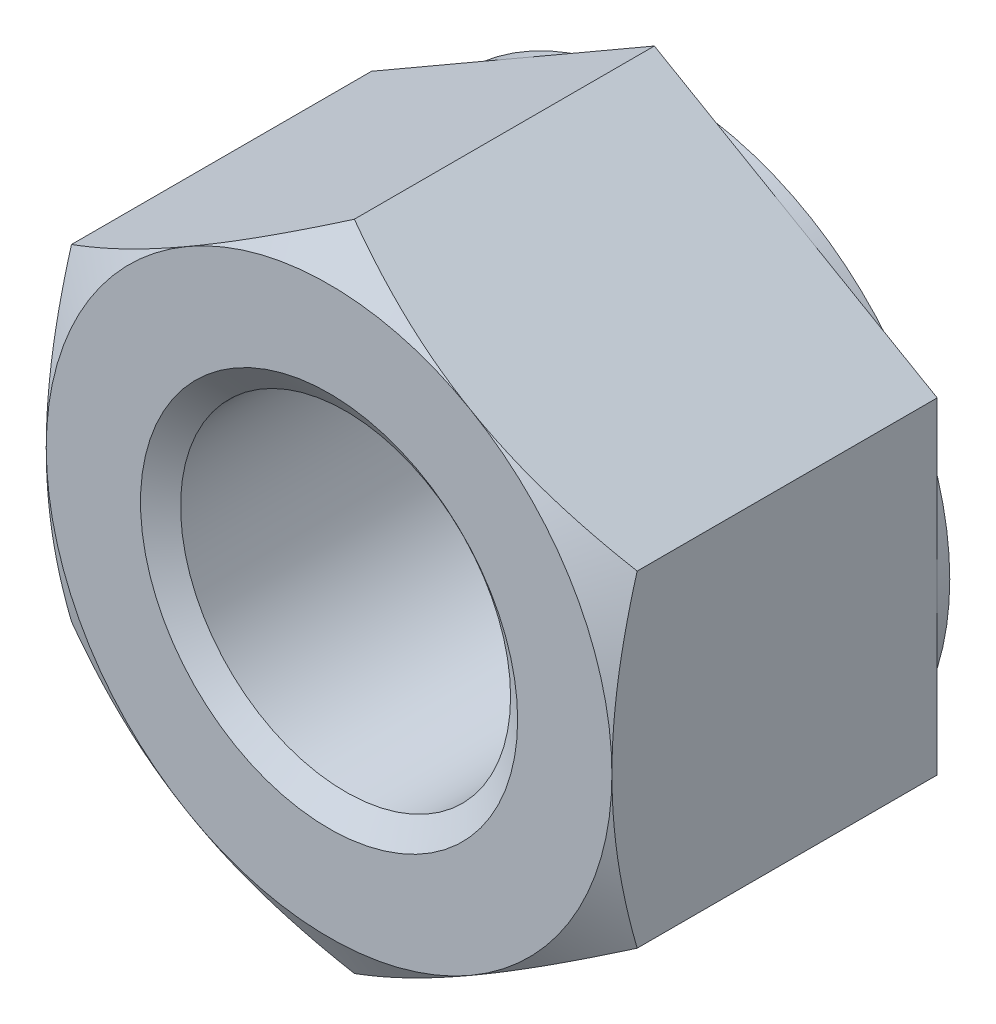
SolidWorks part; units mm, degrees
ref_plane "Plane1" through (0, 0, 0) normal (0, 0, 1) x (1, 0, 0)
ref_plane "Plane2" through (0, 0, 0) normal (0, 1, 0) x (1, 0, 0)
ref_plane "Plane3" through (0, 0, 0) normal (1, 0, 0) x (0, 0, -1)
sketch "BaseNutSke" plane through (0, 0, 0) normal (0, 0, 1) x (1, 0, 0)
  line L6 (18, 10.3923) -> (18, -10.3923)
  line L7 (-18, 10.3923) -> (-18, -10.3923)
  line L8 (18, 10.3923) -> (0, 20.7846)
  line L9 (0, 20.7846) -> (-18, 10.3923)
  line L10 (-18, -10.3923) -> (0, -20.7846)
  line L11 (0, -20.7846) -> (18, -10.3923)
  circle A0 centre (0, 0) radius 10.5
  dimension "D4" = 18
  dimension "Tap_drill" = 21
  dimension "D1" = 120
  dimension "D2" = 18
  dimension "D3" = 18
  dimension "Width_flats" = 36
extrude "BaseNut" add sketch "BaseNutSke" against normal blind 21.5
sketch "Sketch4" plane through (0, 0, 0) normal (1, 0, 0) x (0, 0, -1)
  line L0 (21.5, 18) -> (20.7, 18)
  line L1 (21.5, 18) -> (21.5, 30.7846)
  line L2 (20.7, 30.7846) -> (21.5, 30.7846)
  line L3 (20.7, 30.7846) -> (20.7, 18)
  line L4 (0, 0) -> (34.925, 0) construction
  line L6 (21.5, 10.3923) -> (21.5, 20.7846) construction
  line L7 (0, 18) -> (-10, 18)
  line L8 (0, 10.3923) -> (0, 20.7846) construction
  line L9 (1.6077, 20.7846) -> (1.6077, 30.7846)
  line L10 (1.6077, 30.7846) -> (-10, 30.7846)
  line L11 (-10, 30.7846) -> (-10, 18)
  line L12 (0, 18) -> (1.6077, 20.7846)
  line L14 (0, 10.3923) -> (0, -10.3923) construction
  line L15 (21.5, 20.7846) -> (0, 20.7846) construction
  dimension "D1" = 18
  dimension "D2" = 30
  dimension "Bearing_ht" = 0.8
  dimension "D3" = 10
  dimension "D4" = 10
revolve "Bearing-Face" cut sketch "Sketch4" angle 360 about L4
sketch "Sketch3" plane through (0, 0, 0) normal (1, 0, 0) x (0, 0, -1)
  line L0 (21.5, 18) -> (19.8923, 20.7846)
  line L1 (19.8923, 20.7846) -> (19.8923, 30.7846)
  line L2 (19.8923, 30.7846) -> (31.5, 30.7846)
  line L3 (31.5, 30.7846) -> (31.5, 18)
  line L4 (31.5, 18) -> (21.5, 18)
  line L5 (21.5, 10.3923) -> (21.5, 20.7846) construction
  line L6 (20.7, 20.7846) -> (1.6077, 20.7846) construction
  line L7 (0, 0) -> (38.6776, 0) construction
  line L8 (21.5, 0) -> (0, 0) construction
  line L9 (11.1538, 20.7846) -> (11.1538, 44.222) construction
  line L10 (2.4154, 30.7846) -> (-9.1923, 30.7846)
  line L11 (-9.1923, 30.7846) -> (-9.1923, 18)
  line L12 (-9.1923, 18) -> (0.8077, 18)
  line L13 (0.8077, 18) -> (2.4154, 20.7846)
  line L14 (2.4154, 20.7846) -> (2.4154, 30.7846)
  line L15 (20.7, 20.7846) -> (1.6077, 20.7846) construction
  line L16 (20.7, 20.7846) -> (1.6077, 20.7846) construction
  dimension "D1" = 18
  dimension "D2" = 30
  dimension "D3" = 10
  dimension "D4" = 10
revolve "Double-Chamfer" [suppressed] cut sketch "Sketch3" angle 360 about L7
sketch "Sketch5"
  line L0 (21.5, 12) -> (20.4497, 10.5)
  line L2 (21.5, 12) -> (21.5, 10.5)
  line L3 (21.5, 10.5) -> (20.4497, 10.5)
  line L7 (0, 12) -> (1.0503, 10.5)
  line L9 (1.0503, 10.5) -> (0, 10.5)
  line L10 (0, 10.5) -> (0, 12)
  line L11 (22.6067, 0) -> (38.388, 0) construction
  line L12 (21.5, 0) -> (0, 0) construction
revolve "ThreadSchematic" cut sketch "ThdSchSke" angle 360 about L6
sketch "ThdSchSke" plane through (0, 0, 0) normal (0, 1, 0) x (1, 0, 0)
  line L0 (-12, 2.1006) -> (-10.5, 3.1509)
  line L1 (-10.5, 3.1509) -> (-6, 3.1509)
  line L2 (-6, 3.1509) -> (-6, 1.0503)
  line L3 (-6, 1.0503) -> (-10.5, 1.0503)
  line L4 (-10.5, 1.0503) -> (-12, 2.1006)
  line L5 (-3.175, 3) -> (3.175, 3) construction
  line L6 (0, 3) -> (0, -2.9874) construction
  line L7 (0, 20.4497) -> (0, 1.0503) construction
  dimension "VeeAngle" = 70
  dimension "SideAngle" = 55
  dimension "OverCut" = 12
  dimension "Advance" = 3
  dimension "Thread_major" = 24
revolve "EndChamfer" cut sketch "Sketch5" angle 360 about L11
pattern_linear "ThdSchPat" [suppressed] count 7 spacing 3
equation "\"D2@BaseNutSke\" = \"Width_flats@BaseNutSke\" / 2"
equation "\"D3@BaseNutSke\" = \"Width_flats@BaseNutSke\" / 2"
equation "\"D1@Sketch3\" = \"Width_flats@BaseNutSke\" /2"
equation "\"D1@Sketch4\" = \"D2@BaseNutSke\""
equation "\"D4@BaseNutSke\" = \"D3@BaseNutSke\""
equation "\"Thread_major@ThdSchSke\" = \"Thread_major@ThreadCosmetic\""
equation "' \"Num_threads@ThdSchPat\" = \"Num_threads@ThdSchPat\" - sgn( \"Num_threads@ThdSchPat\" - 1) '---chamfered tips only---"
equation "\"ThreadMajor@Sketch5\" = \"Thread_major@ThreadCosmetic\" * 0.5"
equation "\"OverCut@ThdSchSke\" = \"Thread_major@ThdSchSke\" / 2"
equation "\"D3@ThdSchPat\" = \"Advance@ThdSchSke\""
equation "\"D1@ThdSchPat\" =  int( \"Thickness@BaseNut\" / \"Advance@ThdSchSke\" ) "
